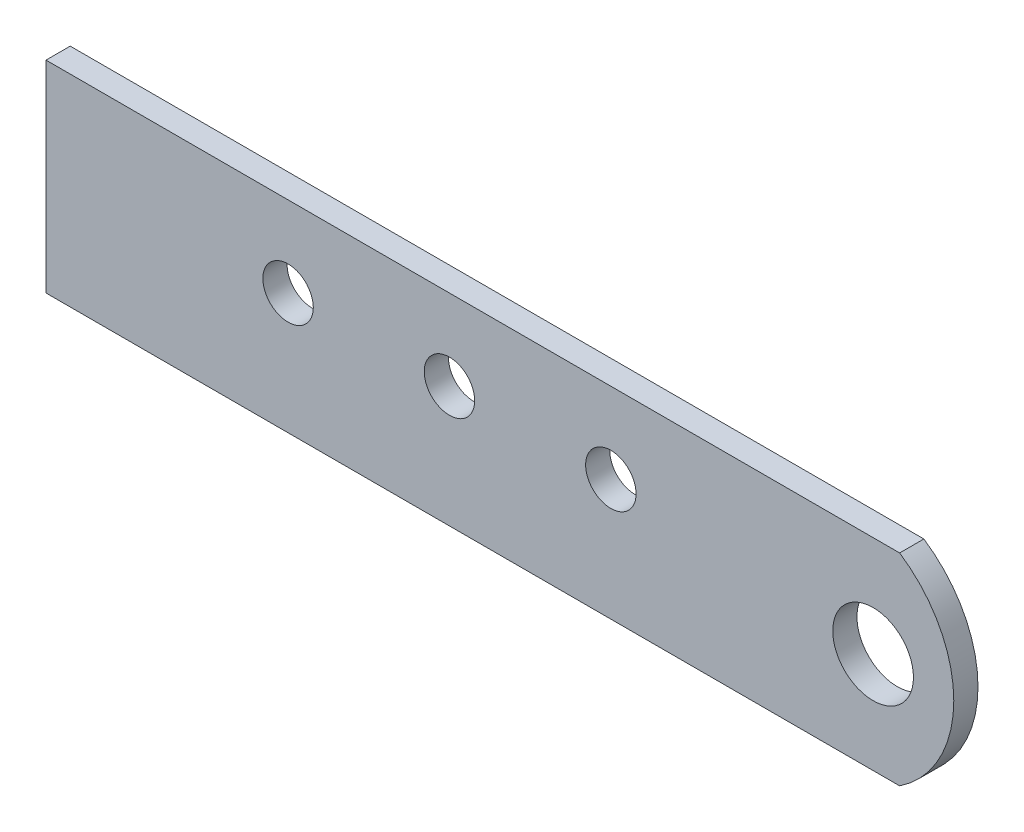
SolidWorks part; units mm, degrees
ref_plane "Plan de face" through (0, 0, 0) normal (0, 0, 1) x (1, 0, 0)
ref_plane "Plan de dessus" through (0, 0, 0) normal (0, 1, 0) x (1, 0, 0)
ref_plane "Plan de droite" through (0, 0, 0) normal (1, 0, 0) x (0, 0, -1)
sketch "Esquisse1" plane through (0, 0, 0) normal (0, 0, 1) x (1, 0, 0)
  line L0 (0, -50) -> (400.4532, -50) construction
  line L1 (0, 0) -> (423.1662, 0)
  line L2 (0, 0) -> (0, -100)
  line L3 (0, -100) -> (423.1662, -100)
  circle A0 centre (410, -50) radius 20
  arc A1 (423.1662, -100) -> (423.1662, 0) centre (390, -50) ccw
  circle A2 centre (120, -40) radius 12.5
  circle A3 centre (200, -40) radius 12.5
  circle A4 centre (280, -40) radius 12.5
  dimension "D4" = 120
  dimension "D3" = 410
  dimension "D2" = 40
  dimension "D6" = 80
  dimension "D7" = 25
  dimension "D8" = 25
  dimension "D9" = 25
  dimension "D10" = 40
  dimension "D1" = 100
  dimension "D5" = 80
extrude "Extrusion1" add sketch "Esquisse1" along normal blind 12
